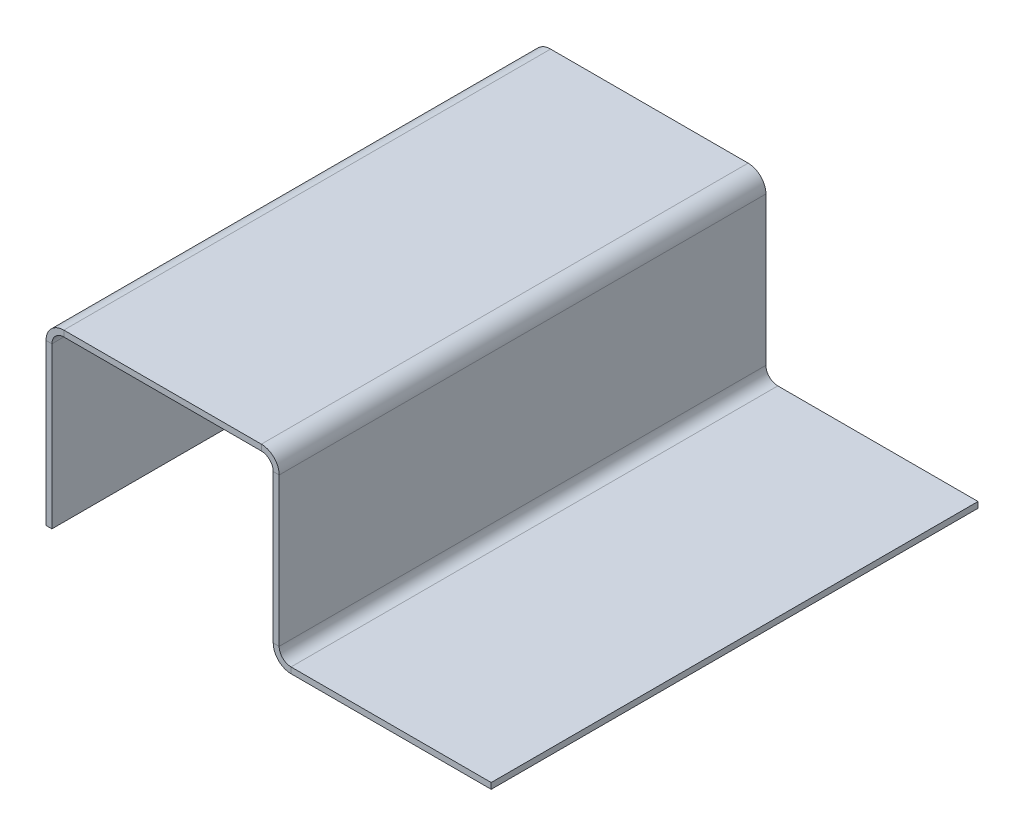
SolidWorks part; units mm, degrees
ref_plane "Front" through (0, 0, 0) normal (0, 0, 1) x (1, 0, 0)
ref_plane "Top" through (0, 0, 0) normal (0, 1, 0) x (1, 0, 0)
ref_plane "Right" through (0, 0, 0) normal (1, 0, 0) x (0, 0, -1)
sketch "Sketch1" plane through (0, 0, 0) normal (0, 0, 1) x (1, 0, 0)
  line L0 (0, 0) -> (0, 27)
  line L1 (3, 30) -> (36.2766, 30)
  line L2 (39.2766, 27) -> (39.2766, 2)
  line L3 (41.2766, 0) -> (75, 0)
  arc A0 (0, 27) -> (3, 30) centre (3, 27) cw
  arc A1 (36.2766, 30) -> (39.2766, 27) centre (36.2766, 27) cw
  arc A2 (39.2766, 2) -> (41.2766, 0) centre (41.2766, 2) ccw
  point P12 (39.2766, 0)
  dimension "D1" = 3
  dimension "D4" = 2
  dimension "D2" = 75
  dimension "D3" = 30
extrude "Extrude-Thin1" add sketch "Sketch1" along normal mid plane 82 thin
sheet metal parameters "Sheet-Metal3" parameters "D1"=2
bend "RoundBend1" bend radius 2 bend angle 90 parameters "D5"=1
flatten bends "Flatten-Bends3"
sketch "Sharp-Sketch3" plane through (0, 0, 0) normal (0, 1, 0) x (-1, 0, 0)
  line L0 (-38.9204, -41) -> (-38.9204, 41) construction
  line L1 (-9.208, 41) -> (-9.208, -41) construction
  line L2 (28.781, 41) -> (28.781, -41) construction
bend "RoundBend2" bend radius 2 bend angle 90 parameters "D5"=2
bend "RoundBend3" bend radius 2 bend angle 90 parameters "D5"=3
process bends "Process-Bends3" parameters "D1"=0
sketch "Flat-Sketch3" plane through (0, 0, 0) normal (0, 1, 0) x (-1, 0, 0)
